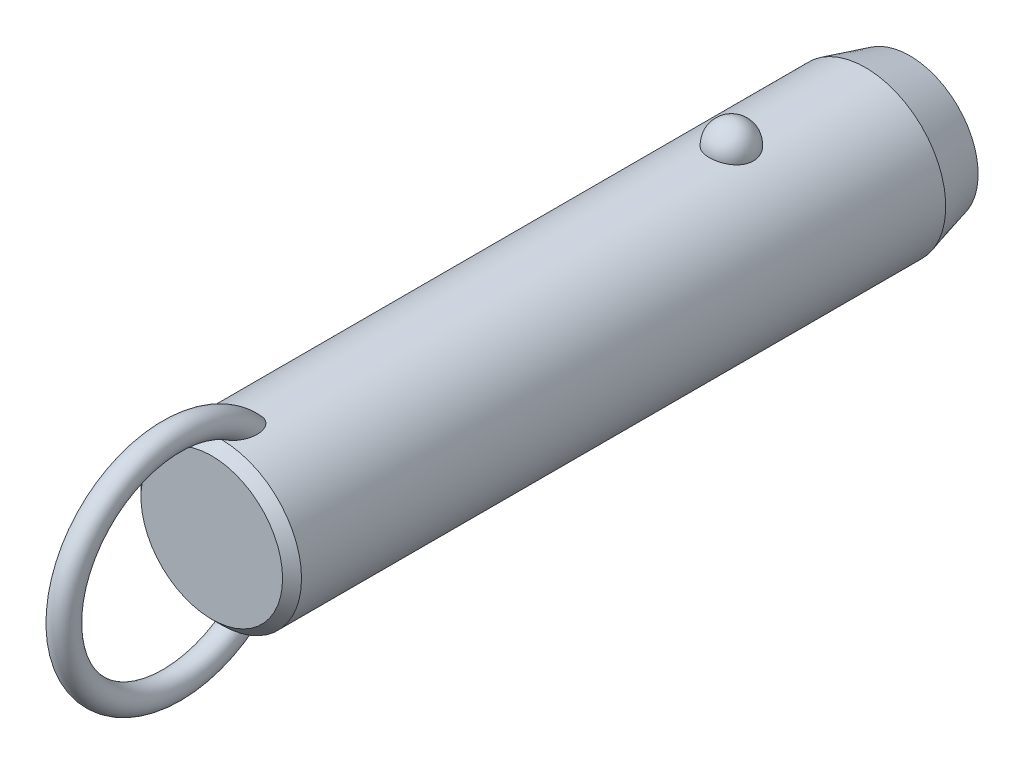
SolidWorks part; units mm, degrees
ref_plane "Front Plane" through (0, 0, 0) normal (0, 0, 1) x (1, 0, 0)
ref_plane "Top Plane" through (0, 0, 0) normal (0, 1, 0) x (1, 0, 0)
ref_plane "Right Plane" through (0, 0, 0) normal (1, 0, 0) x (0, 0, -1)
sketch "Sketch2" plane through (0, 0, 0) normal (0, 0, 1) x (1, 0, 0)
  circle A0 centre (0, 0) radius 12.7
  point P3 (0, 12.7)
  dimension "D1" = 25.4
extrude "Boss-Extrude1" add sketch "Sketch2" along normal blind 66
sketch "Sketch3" plane through (0, 0, 0) normal (0, 0, -1) x (-1, 0, 0)
  circle A0 centre (0, 0) radius 12.7
  dimension "D1" = 25.4
extrude "Boss-Extrude2" add sketch "Sketch3" along normal blind 31.7
chamfer "Chamfer1" distance 7 angle 15 1 edges at (-12.7, 0, -31.7)
sketch "Sketch12" plane through (0, 0, 0) normal (1, 0, 0) x (0, 0, -1)
  line L0 (-66, 12.7) -> (-66, -12.7) construction
  point P0 (-66, 0)
sketch "Sketch13" plane through (0, 0, 0) normal (1, 0, 0) x (0, 0, -1)
  circle A0 centre (-85.05, 0) radius 19.05
  point P2 (-66, 0)
  dimension "D1" = 38.1
sketch "Sketch14" plane through (0, 0, 0) normal (0, 1, 0) x (1, 0, 0)
  circle A0 centre (0, -68) radius 2
  point P2 (0, -66)
  dimension "D1" = 4
sweep "Sweep1" add profiles "Sketch14" path "Sketch13"
sketch "Sketch15" plane through (0, 0, 66) normal (0, 0, 1) x (1, 0, 0)
  circle A0 centre (0, 0) radius 12.7
  dimension "D1" = 25.4
extrude "Boss-Extrude3" add sketch "Sketch15" along normal blind 12.7
chamfer "Chamfer2" distance 1.5 angle 45 1 edges at (12.7, 0, 78.7)
sketch "Sketch18" plane through (0, 0, 0) normal (1, 0, 0) x (0, 0, -1)
  line L0 (24.7, 12.7) -> (-70.851, 12.7) construction
  line L1 (3.5, 16.2) -> (3.5, 9.2)
  line L2 (-70.851, -12.7) -> (24.7, -12.7) construction
  arc A0 (3.5, 16.2) -> (3.5, 9.2) centre (3.5, 12.7) ccw
  point P4 (0, 12.7)
  dimension "D1" = 28.9
revolve "Revolve1" add sketch "Sketch18" angle 360 about L1
